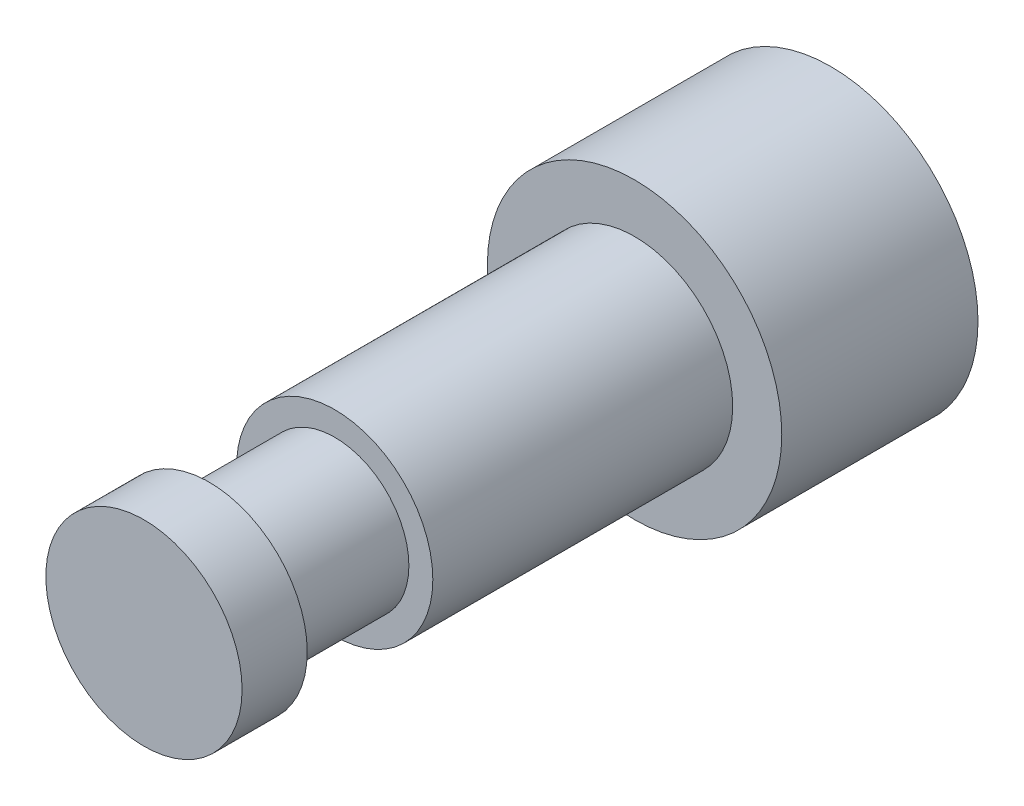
SolidWorks part; units mm, degrees
ref_plane "Plane1" through (0, 0, 0) normal (0, 0, 1) x (1, 0, 0)
ref_plane "Plane2" through (0, 0, 0) normal (0, 1, 0) x (1, 0, 0)
ref_plane "Plane3" through (0, 0, 0) normal (1, 0, 0) x (0, 0, -1)
sketch "Sketch1" plane through (0, 0, 0) normal (0, 0, 1) x (1, 0, 0)
  circle A0 centre (0, 0) radius 4.7625
extrude "Base-Extrude" add sketch "Sketch1" along normal blind 6.35
sketch "Sketch2" plane through (0, 0, 6.35) normal (0, 0, 1) x (1, 0, 0)
  circle A0 centre (0, 0) radius 3.175
extrude "Boss-Extrude1" add sketch "Sketch2" along normal blind 9.7028
sketch "Sketch3" plane through (0, 0, 16.0528) normal (0, 0, 1) x (1, 0, 0)
  circle A0 centre (0, 0) radius 2.4003
extrude "Boss-Extrude2" add sketch "Sketch3" along normal blind 4.064
sketch "Sketch4" plane through (0, 0, 20.1168) normal (0, 0, 1) x (1, 0, 0)
  circle A0 centre (0, 0) radius 3.175
extrude "Boss-Extrude3" add sketch "Sketch4" along normal blind 2.1082
